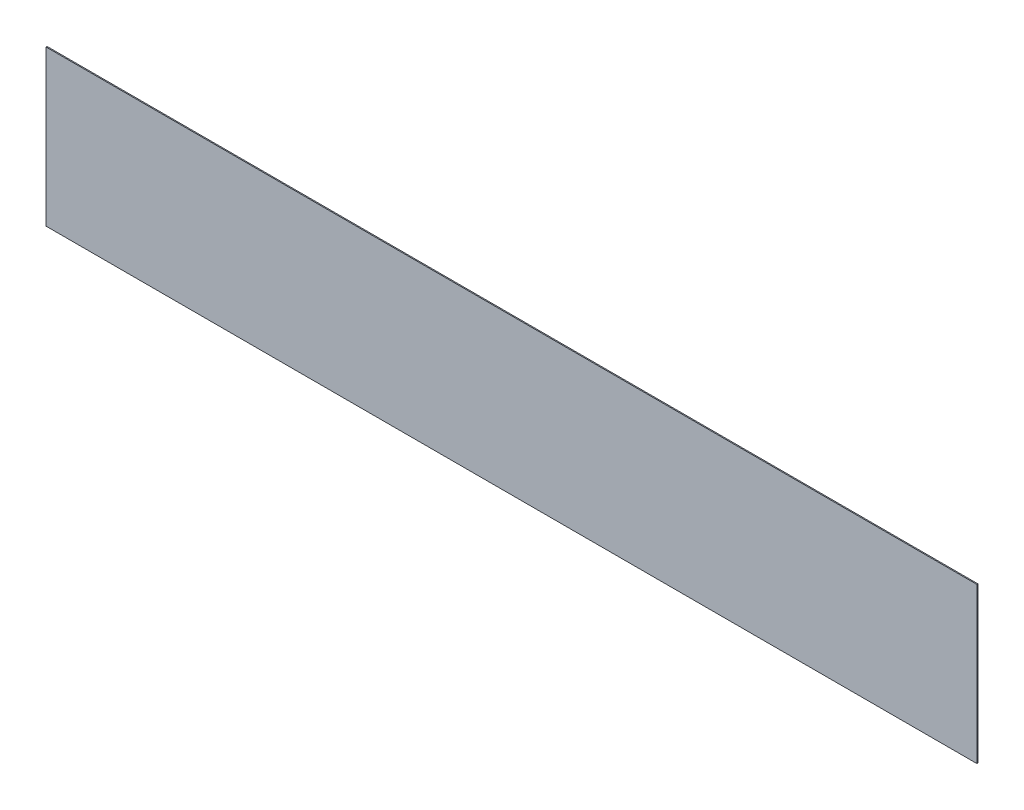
SolidWorks part; units mm, degrees
ref_plane "Front Plane" through (0, 0, 0) normal (0, 0, 1) x (1, 0, 0)
ref_plane "Top Plane" through (0, 0, 0) normal (0, 1, 0) x (1, 0, 0)
ref_plane "Right Plane" through (0, 0, 0) normal (1, 0, 0) x (0, 0, -1)
sketch "Sketch1" plane through (0, 0, 0) normal (0, 0, 1) x (1, 0, 0)
  line L1 (0, 190.5) -> (2286, 190.5)
  line L2 (0, 190.5) -> (0, -190.5)
  line L3 (0, -190.5) -> (2286, -190.5)
  line L4 (2286, 190.5) -> (2286, -190.5)
  dimension "D1" = 381
  dimension "D2" = 2286
extrude "Extrude1" add sketch "Sketch1" along normal blind 2.54
